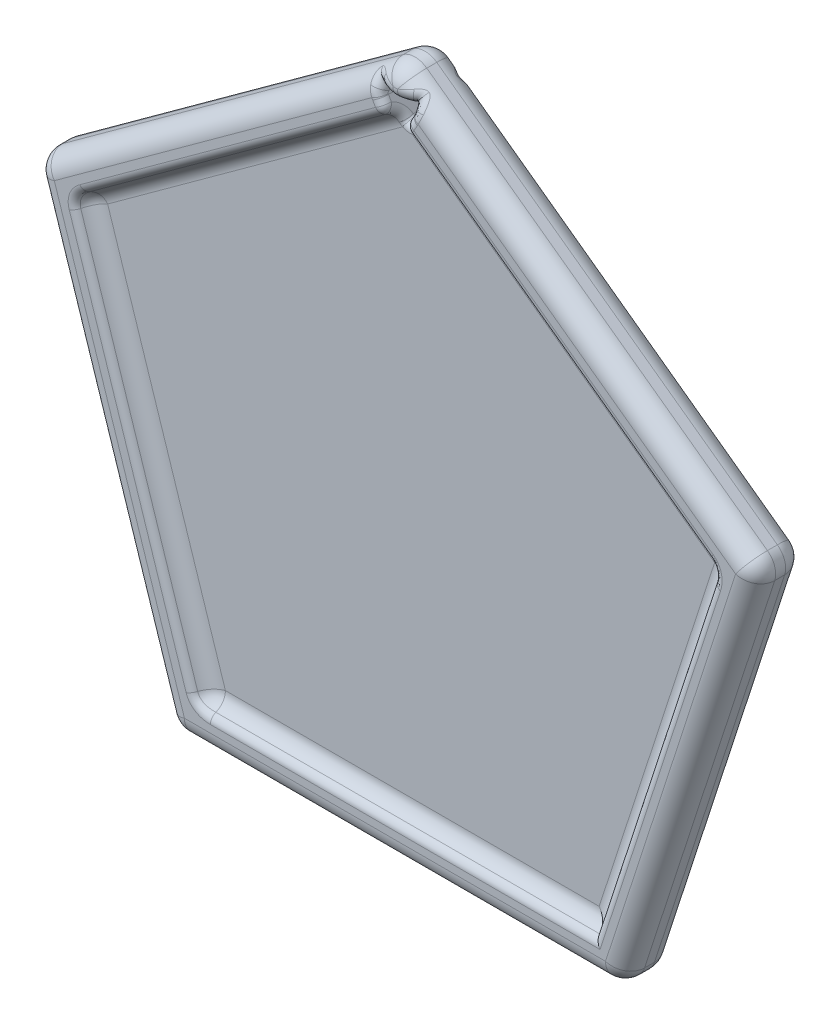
SolidWorks part; units mm, degrees
ref_plane "Ön Düzlem" through (0, 0, 0) normal (0, 0, 1) x (1, 0, 0)
ref_plane "Üst Düzlem" through (0, 0, 0) normal (0, 1, 0) x (1, 0, 0)
ref_plane "Sağ Düzlem" through (0, 0, 0) normal (1, 0, 0) x (0, 0, -1)
sketch "Çizim1" plane through (0, 0, 0) normal (0, 0, 1) x (1, 0, 0)
  line L1 (0, 76.5586) -> (-72.8115, 23.6579)
  line L2 (-72.8115, 23.6579) -> (-45, -61.9372)
  line L3 (-45, -61.9372) -> (45, -61.9372)
  line L4 (45, -61.9372) -> (72.8115, 23.6579)
  line L5 (72.8115, 23.6579) -> (0, 76.5586)
  dimension "D1" = 90
extrude "Yükseklik-Ekstrüzyon1" add sketch "Çizim1" along normal blind 10
sketch "Çizim2" plane through (0, 0, 10) normal (0, 0, 1) x (1, 0, 0)
  line L1 (0, 68.0521) -> (-64.7214, 21.0292)
  line L2 (-64.7214, 21.0292) -> (-40, -55.0553)
  line L3 (-40, -55.0553) -> (40, -55.0553)
  line L4 (40, -55.0553) -> (64.7214, 21.0292)
  line L5 (64.7214, 21.0292) -> (0, 68.0521)
  dimension "D1" = 80
extrude "Kes-Ekstrüzyon1" cut sketch "Çizim2" against normal blind 3
sketch "Çizim3" plane through (0, 0, 0) normal (0, 0, -1) x (-1, 0, 0)
  line L1 (0, 68.0521) -> (-64.7214, 21.0292)
  line L2 (-64.7214, 21.0292) -> (-40, -55.0553)
  line L3 (-40, -55.0553) -> (40, -55.0553)
  line L4 (40, -55.0553) -> (64.7214, 21.0292)
  line L5 (64.7214, 21.0292) -> (0, 68.0521)
  circle A0 centre (0, 0) radius 55.0553 construction
  dimension "D1" = 80
extrude "Kes-Ekstrüzyon2" cut sketch "Çizim3" against normal blind 3
sketch "Çizim5" plane through (0, 0, 10) normal (0, 0, 1) x (1, 0, 0)
  line L1 (0.866, 65.1006) -> (2.989, 68.7778)
  line L2 (2.123, 70.2778) -> (-2.123, 70.2778)
  line L3 (-2.989, 68.7778) -> (-0.866, 65.1006)
  circle A0 centre (0, 68.0521) radius 2.2257 construction
  arc A1 (0.866, 65.1006) -> (-0.866, 65.1006) centre (0, 65.6006) cw
  arc A2 (2.989, 68.7778) -> (2.123, 70.2778) centre (2.123, 69.2778) ccw
  arc A3 (-2.123, 70.2778) -> (-2.989, 68.7778) centre (-2.123, 69.2778) ccw
  dimension "D1" = 1
extrude "Kes-Ekstrüzyon4" cut sketch "Çizim5" against normal blind 20
fillet "Radyus1" radius 4 21 edges at (0, -61.9372, 10) (0, -61.9372, 0) (-58.9058, -19.1396, 10) (-45, -61.9372, 5) (-58.9058, -19.1396, 0) (45, -61.9372, 5) (58.9058, -19.1396, 10) (58.9058, -19.1396, 0) (-36.4058, 50.1082, 10) (-72.8115, 23.6579, 5) (-36.4058, 50.1082, 0) (72.8115, 23.6579, 5) (36.4058, 50.1082, 10) (0, 76.5586, 5) (36.4058, 50.1082, 0) (-52.3607, -17.013, 7) (33.266, 43.8829, 7) (0, -55.0553, 3) (52.3607, -17.013, 3) (-52.3607, -17.013, 3) (-33.266, 43.8829, 3)
fillet "Radyus2" radius 3 7 edges at (-38.5033, -55.0553, 7.8377) (64.2588, 19.6058, 7.8377) (-2.5333, 66.2115, 7.1014) (-32.3607, 44.5407, 7) (2.0361, -55.0553, 7) (51.7315, -18.9495, 7) (-63.5105, 21.909, 7.8377)
fillet "Radyus3" radius 1.7 18 edges at (2.3998, 67.7572, 0) (1.9813, 70.2778, 0.0009) (-1.9813, 70.2778, 0.0009) (-3.0973, 69.0526, 0) (-1.4634, 66.1353, 1.4232) (0.063, 64.6026, 2.861) (1.8106, 66.7366, 1.2998) (1.3471, 65.9339, 2.759) (3.0973, 69.0526, 0) (2.7475, 70.0588, 0.0159) (0, 70.2778, 0) (-2.8595, 69.9543, 0.0143) (-2.3998, 67.7572, 0) (-52.3607, -17.013, 0) (0, -55.0553, 0) (52.3607, -17.013, 0) (33.266, 43.8829, 0) (-33.266, 43.8829, 0)
fillet "Radyus4" radius 1.7 12 edges at (1.4634, 66.1353, 8.5768) (0.544, 64.7615, 7.3044) (2.3998, 67.7572, 10) (3.0973, 69.0526, 10) (2.8595, 69.9543, 9.9857) (1.9813, 70.2778, 9.9991) (0, 70.2778, 10) (-1.9813, 70.2778, 9.9991) (-2.7475, 70.0588, 9.9841) (-3.0973, 69.0526, 10) (-1.3511, 65.9407, 7.9346) (-2.3961, 67.7508, 10)
fillet "Radyus5" radius 1.7 10 edges at (51.8821, -18.486, 10) (64.0375, 20.7303, 10) (2.4119, 66.5209, 9.6199) (-2.467, 66.5483, 9.6468) (1.5488, -55.0553, 10) (-39.5085, -54.4945, 10) (-52.3607, -17.013, 10) (-63.9923, 20.8691, 10) (33.0632, 44.0302, 10) (-32.7044, 44.2909, 10)
fillet "Radyus7" radius 2 3 edges at (2.4863, 66.5409, 3.3315) (65.2242, 21.6873, 0.2407) (64.2616, 21.4392, 1.2472)
sketch "Çizim6" plane through (0, 0, 3) normal (0, 0, -1) x (-1, 0, 0)
  line L0 (-1244.3401, -659.7772) -> (-177.6734, -659.7772) construction
  line L1 (-25.869, -6.219) -> (-0.0001, -6.219)
  line L2 (-0.0001, -6.2189) -> (-0.0001, -6.219)
  line L3 (-12.7245, -28.3784) -> (-38.6246, -28.3784)
  line L4 (-38.6246, -28.3784) -> (-25.869, -6.219)
  line L5 (0, -6.219) -> (12.9329, -28.3784)
  line L6 (12.9329, -28.3784) -> (38.5902, -28.3784)
  line L7 (38.5902, -28.3784) -> (25.7616, -6.3975)
  line L8 (25.7616, -6.3975) -> (0.0002, -6.219)
  line L9 (0.0001, -6.2189) -> (13.0367, 16.1821)
  line L10 (13.0367, 16.1821) -> (0, 38.6125)
  line L11 (0, 38.6125) -> (-13.0538, 16.182)
  line L12 (-13.0538, 16.182) -> (-0.0001, -6.2189)
  line L16 (0.0001, -6.2189) -> (0.0002, -6.219)
  line L17 (-12.7245, -28.3784) -> (0, -6.219)
extrude "Yükseklik-Ekstrüzyon11" add sketch "Çizim6" along normal blind 3
fillet "Radyus23" radius 1 9 edges at (-32.1759, -17.388, 0) (25.6745, -28.3784, 0) (-6.5183, 27.3973, 0) (-6.5184, 4.9816, 0) (6.5269, 27.3973, 0) (6.3622, -17.2987, 0) (32.2468, -17.2987, 0) (-25.7616, -28.3784, 0) (-12.8809, -6.3083, 0)
fillet "Radyus24" radius 1 12 edges at (6.3622, -17.2987, 3) (-6.4664, -17.2987, 3) (-25.7616, -28.3784, 3) (-32.1759, -17.388, 3) (-12.8809, -6.3083, 3) (-6.5184, 4.9816, 3) (-6.5183, 27.3973, 3) (6.5269, 27.3973, 3) (6.5269, 4.9816, 3) (12.9346, -6.219, 3) (32.2468, -17.2987, 3) (25.6745, -28.3784, 3)
fillet "Radyus25" radius 1 4 edges at (26.0384, -5.9261, 2.7071) (25.869, -6.219, 1.5) (25.5311, -6.219, 0.2929) (12.9342, -6.219, 0)
